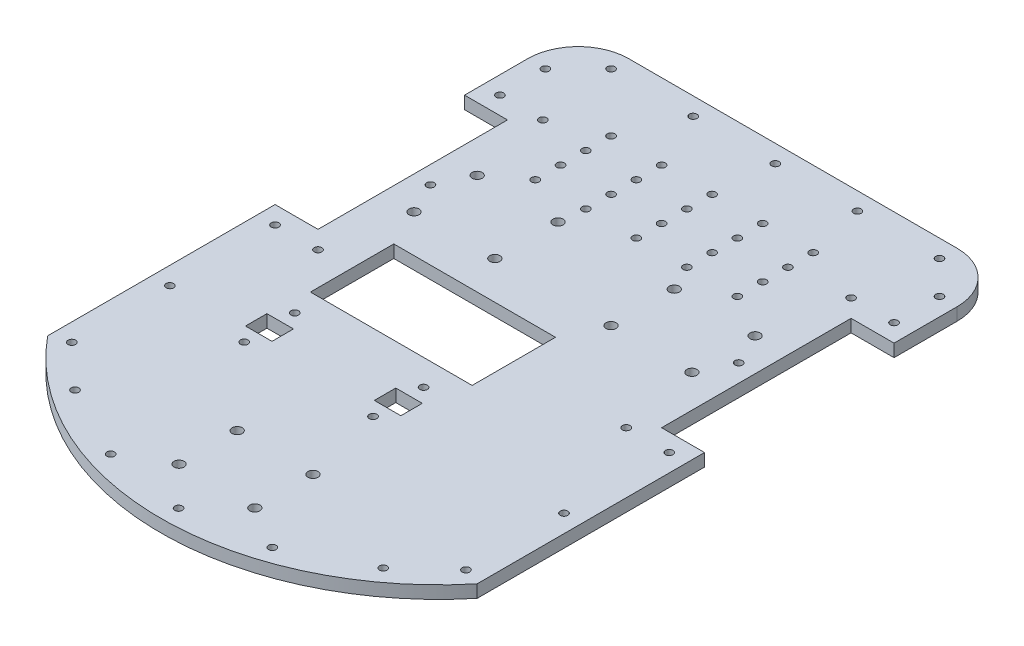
SolidWorks part; units mm, degrees
ref_plane "Front" through (0, 0, 0) normal (0, 0, 1) x (1, 0, 0)
ref_plane "Top" through (0, 0, 0) normal (0, 1, 0) x (1, 0, 0)
ref_plane "Right" through (0, 0, 0) normal (1, 0, 0) x (0, 0, -1)
sketch "Sketch1" plane through (0, 0, 0) normal (0, 1, 0) x (1, 0, 0)
  line L0 (0, 179.8705) -> (0, -170.2797) construction
  line L1 (-65, 145) -> (65, 145)
  line L2 (-85, 125) -> (-85, 100)
  line L4 (85, 125) -> (85, 100)
  line L12 (68, 100) -> (85, 100)
  line L13 (68, 100) -> (68, 25)
  line L14 (68, 25) -> (85, 25)
  line L20 (-68, 25) -> (-85, 25)
  line L22 (-68, 100) -> (-85, 100)
  line L23 (-68, 100) -> (-68, 25)
  line L24 (85, 25) -> (85, -65)
  line L25 (-128.9167, 62.5) -> (175.707, 62.5) construction
  line L26 (16, 2) -> (-48, 2)
  line L27 (-23, 50) -> (-55, 50) construction
  line L28 (-85, 25) -> (-85, -65)
  line L29 (-23, 50) -> (-23, 75) construction
  line L30 (-23, 75) -> (-55, 75) construction
  line L31 (-55, 50) -> (-55, 75) construction
  line L35 (115.1039, 0) -> (-141.1607, 0) construction
  line L36 (55, 50) -> (55, 75) construction
  line L37 (23, 50) -> (23, 75) construction
  line L38 (16, 2) -> (16, 35)
  line L39 (16, 35) -> (-48, 35)
  line L40 (-48, 2) -> (-48, 35)
  arc A2 (65, 145) -> (85, 125) centre (65, 125) cw
  arc A3 (-65, 145) -> (-85, 125) centre (-65, 125) ccw
  circle A6 centre (-23, 50) radius 2
  circle A7 centre (-55, 50) radius 2
  circle A8 centre (-55, 75) radius 2
  circle A9 centre (-23, 75) radius 2
  circle A14 centre (55, 75) radius 2
  circle A15 centre (55, 50) radius 2
  circle A16 centre (23, 75) radius 2
  circle A17 centre (23, 50) radius 2
  arc A24 (85, -65) -> (-85, -65) centre (0, 4.8212) cw
  circle A25 centre (15, -83) radius 2
  circle A26 centre (-15, -83) radius 2
  circle A27 centre (-15, -60) radius 2
  circle A28 centre (15, -60) radius 2
  point P0 (0, 0)
  dimension "D3" = 145
  dimension "D4" = 20
  dimension "D5" = 64
  dimension "D12" = 4
  dimension "D13" = 25
  dimension "D10" = 4
  dimension "D22" = 110
  dimension "D2" = 170
  dimension "D6" = 75
  dimension "D7" = 45
  dimension "D8" = 17
  dimension "D9" = 32
  dimension "D11" = 13
  dimension "D14" = 30
  dimension "D15" = 23
  dimension "D16" = 60
  dimension "D17" = 33
  dimension "D18" = 110
  dimension "D19" = 16
  dimension "D20" = 12.5
  dimension "D21" = 90
extrude "Boss-Extrude1" add sketch "Sketch1" along normal blind 5
sketch "Sketch4" plane through (0, 5, 0) normal (0, 1, 0) x (1, 0, 0)
  line L16 (12.29, -14) -> (1.79, -14)
  line L17 (12.29, -14) -> (12.29, -22.5)
  line L18 (12.29, -22.5) -> (1.79, -22.5)
  line L19 (1.79, -14) -> (1.79, -22.5)
  line L20 (-49.21, -14) -> (-38.71, -14)
  line L21 (-49.21, -14) -> (-49.21, -22.5)
  line L22 (-49.21, -22.5) -> (-38.71, -22.5)
  line L23 (-38.71, -14) -> (-38.71, -22.5)
  line L24 (-48, 2) -> (16, 2) construction
  line L25 (16, 2) -> (16, 35) construction
  line L26 (7.04, -9.5619) -> (7.04, -37.1607) construction
  line L27 (-12.633, -18.25) -> (21.7522, -18.25) construction
  line L28 (-43.96, -11.915) -> (-43.96, -33.9698) construction
  circle A1 centre (-43.96, -28.25) radius 1.5
  circle A2 centre (-43.96, -8.25) radius 1.5
  circle A3 centre (7.04, -8.25) radius 1.5
  circle A4 centre (7.04, -28.25) radius 1.5
  dimension "D7" = 3
  dimension "D2" = 8.5
  dimension "D3" = 10.5
  dimension "D4" = 16
  dimension "D5" = 40.5
  dimension "D6" = 3.71
  dimension "D8" = 20
extrude "Cut-Extrude2" cut sketch "Sketch4" against normal up to next
sketch "Sketch5" plane through (0, 5, 0) normal (0, 1, 0) x (1, 0, 0)
  line L33 (65, 138) -> (-65, 138)
  line L34 (-78, 125) -> (-78, 107)
  line L35 (-78, 107) -> (-61, 107)
  line L36 (-61, 107) -> (-61, 18)
  line L37 (-61, 18) -> (-78, 18)
  line L38 (-78, 18) -> (-78, -62.4469)
  line L39 (78, -62.4469) -> (78, 18)
  line L40 (78, 18) -> (61, 18)
  line L41 (61, 18) -> (61, 107)
  line L42 (61, 107) -> (78, 107)
  line L43 (78, 107) -> (78, 125)
  line L44 (65, 138) -> (-65, 138)
  line L45 (-78, 125) -> (-78, 107)
  line L46 (-78, 107) -> (-61, 107)
  line L47 (-61, 107) -> (-61, 18)
  line L48 (-61, 18) -> (-78, 18)
  line L49 (-78, 18) -> (-78, -62.4469)
  line L50 (78, -62.4469) -> (78, 18)
  line L51 (78, 18) -> (61, 18)
  line L52 (61, 18) -> (61, 107)
  line L53 (61, 107) -> (78, 107)
  line L54 (78, 107) -> (78, 125)
  arc A9 (78, 125) -> (65, 138) centre (65, 125) ccw
  arc A10 (-65, 138) -> (-78, 125) centre (-65, 125) ccw
  arc A11 (-78, -62.4469) -> (78, -62.4469) centre (0, 4.8212) ccw
  arc A12 (78, 125) -> (65, 138) centre (65, 125) ccw
  arc A13 (-65, 138) -> (-78, 125) centre (-65, 125) ccw
  arc A14 (-78, -62.4469) -> (78, -62.4469) centre (0, 4.8212) ccw
  dimension "D1" = 7
sketch "Sketch6" plane through (0, 5, 0) normal (0, 1, 0) x (1, 0, 0)
  circle A0 centre (-65, 138) radius 1.5
  dimension "D1" = 3
extrude "Cut-Extrude3" cut sketch "Sketch6" against normal through all contours A0
pattern_curve "CrvPattern1" of "Cut-Extrude3" parameters "D1"=5, "D3"=50, "D2"=1, "D4"=50
sketch "Sketch7" plane through (0, 5, 0) normal (0, 1, 0) x (1, 0, 0)
  line L1 (61, 18) -> (61, 107) construction
  line L3 (78, -62.4469) -> (78, 18) construction
  line L4 (0, 224.5276) -> (0, -168.2424) construction
  circle A22 centre (78, 125) radius 1.5
  circle A23 centre (78, 107) radius 1.5
  circle A24 centre (61, 107) radius 1.5
  circle A25 centre (61, 62.5) radius 1.5
  circle A26 centre (61, 18) radius 1.5
  circle A27 centre (78, 18) radius 1.5
  circle A28 centre (78, -23.6224) radius 1.5
  circle A29 centre (78, -62.4469) radius 1.5
  circle A30 centre (61, -78.1728) radius 1.5
  arc A31 (-78, -62.4469) -> (78, -62.4469) centre (0, 4.8212) ccw construction
  circle A32 centre (32, -93.0818) radius 1.5
  circle A33 centre (0, -98.1788) radius 1.5
  circle A34 centre (-32, -93.0818) radius 1.5
  circle A35 centre (-61, -78.1728) radius 1.5
  circle A36 centre (-78, -62.4469) radius 1.5
  circle A37 centre (-61, 18) radius 1.5
  circle A38 centre (-61, 62.5) radius 1.5
  circle A39 centre (-61, 107) radius 1.5
  circle A40 centre (-78, -23.6224) radius 1.5
  circle A41 centre (-78, 18) radius 1.5
  circle A42 centre (-78, 107) radius 1.5
  circle A43 centre (-78, 125) radius 1.5
  dimension "D1" = 3
  dimension "D2" = 17
  dimension "D3" = 29
extrude "Cut-Extrude4" cut sketch "Sketch7" against normal through all
sketch "Sketch8" plane through (0, 0, 0) normal (0, -1, 0) x (1, 0, 0)
  line L0 (38, -131.2907) -> (38, -86.1747) construction
  line L3 (65, -145) -> (-65, -145) construction
  line L4 (68, -25) -> (68, -100) construction
  circle A0 centre (38, -115) radius 1.5
  dimension "D1" = 3
  dimension "D2" = 30
  dimension "D3" = 30
extrude "Cut-Extrude5" cut sketch "Sketch8" against normal through all
pattern_linear "LPattern2" count 5 spacing 20 along (-1, 0, 0) count 4 spacing 10 along (0, 0, 1) of "Cut-Extrude5"
